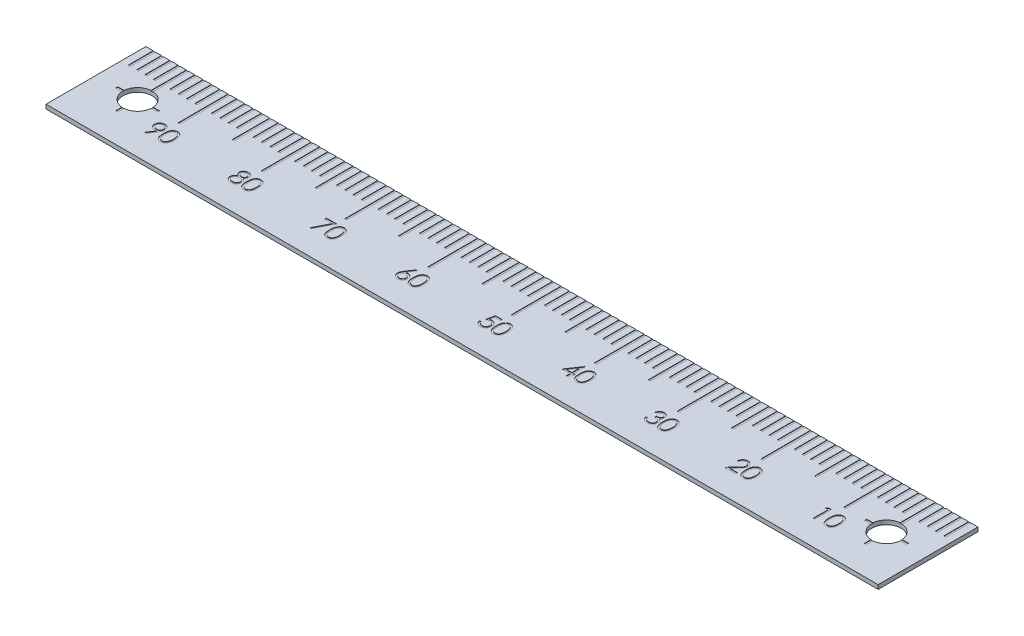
SolidWorks part; units mm, degrees
ref_plane "Front Plane" through (0, 0, 0) normal (0, 0, 1) x (1, 0, 0)
ref_plane "Top Plane" through (0, 0, 0) normal (0, 1, 0) x (1, 0, 0)
ref_plane "Right Plane" through (0, 0, 0) normal (1, 0, 0) x (0, 0, -1)
sketch "Sketch1" plane through (0, 0, 0) normal (0, 1, 0) x (1, 0, 0)
  line L1 (-50, 6) -> (50, 6)
  line L2 (-50, 6) -> (-50, -6)
  line L3 (-50, -6) -> (50, -6)
  line L4 (50, 6) -> (50, -6)
extrude "Boss-Extrude1" add sketch "Sketch1" against normal blind 0.5
sketch "Sketch2" plane through (0, 0, 0) normal (0, 1, 0) x (1, 0, 0)
  line L1 (-49.125, 3) -> (-48.875, 3)
  line L2 (-49.125, 3) -> (-49.125, 6)
  line L3 (-49.125, 6) -> (-48.875, 6)
  line L4 (-48.875, 3) -> (-48.875, 6)
  line L5 (-49, 6) -> (-49, 3) construction
  line L6 (-50, 6) -> (-50, -6) construction
  dimension "D1" = 3
  dimension "D2" = 0.25
  dimension "D3" = 1
extrude "Cut-Extrude2" cut sketch "Sketch2" against normal blind 0.05 contours L4 L3 L2 L1
pattern_linear "LPattern2" count 99 spacing 1 along (1, 0, 0) of "Cut-Extrude2"
sketch "Sketch3" plane through (0, 0, 0) normal (0, 1, 0) x (1, 0, 0)
  line L0 (-40.125, 3) -> (-40.125, 6) construction
  line L6 (-40.125, 3) -> (-39.875, 3)
  line L7 (-40.125, 3) -> (-40.125, 0)
  line L8 (-40.125, 0) -> (-39.875, 0)
  line L9 (-39.875, 3) -> (-39.875, 0)
  dimension "D1" = 0
  dimension "D2" = 0.25
  dimension "D4" = 3
extrude "Cut-Extrude3" cut sketch "Sketch3" against normal blind 0.05
pattern_linear "LPattern3" count 9 spacing 10 along (1, 0, 0) of "Cut-Extrude3"
sketch "Sketch4" plane through (0, 0, 0) normal (0, 1, 0) x (1, 0, 0)
  line L0 (-35.125, 3) -> (-35.125, 6) construction
  line L1 (-35.125, 3) -> (-34.875, 3)
  line L2 (-35.125, 3) -> (-35.125, 1.5)
  line L3 (-35.125, 1.5) -> (-34.875, 1.5)
  line L4 (-34.875, 3) -> (-34.875, 1.5)
  dimension "D1" = 0
  dimension "D2" = 0.25
  dimension "D3" = 3
  dimension "D4" = 1.5
extrude "Cut-Extrude4" cut sketch "Sketch4" against normal blind 0.05
pattern_linear "LPattern4" count 9 spacing 10 along (1, 0, 0) count 2 spacing 10 along (-1, 0, 0) of "Cut-Extrude4"
sketch "Sketch5" plane through (0, 0, 0) normal (0, 1, 0) x (1, 0, 0)
  line L0 (-44.995, 0) -> (-44.995, 2.5) construction
  line L1 (-44.995, 0) -> (-44.995, -2.5) construction
  line L2 (-44.995, 0) -> (-42.495, 0) construction
  line L3 (-44.995, 0) -> (-47.495, 0) construction
  line L5 (-45.12, 2.5) -> (-44.87, 2.5)
  line L6 (-45.12, 2.5) -> (-45.12, 1.7455)
  line L7 (-45.12, -2.5) -> (-44.87, -2.5)
  line L8 (-44.87, 2.5) -> (-44.87, 1.7455)
  line L9 (-47.495, 0.125) -> (-46.7405, 0.125)
  line L10 (-47.495, 0.125) -> (-47.495, -0.125)
  line L11 (-47.495, -0.125) -> (-46.7405, -0.125)
  line L12 (-42.495, 0.125) -> (-42.495, -0.125)
  line L13 (-48.125, 6) -> (-48.875, 6) construction
  line L14 (-45.12, 1.4948) -> (-45.12, 0.125)
  line L15 (-44.87, 1.4948) -> (-44.87, 0.125)
  line L16 (-43.2495, 0.125) -> (-42.495, 0.125)
  line L17 (-43.2495, -0.125) -> (-42.495, -0.125)
  line L18 (-44.87, -1.7455) -> (-44.87, -2.5)
  line L19 (-45.12, -1.7455) -> (-45.12, -2.5)
  line L20 (-46.4898, -0.125) -> (-45.12, -0.125)
  line L21 (-46.4898, 0.125) -> (-45.12, 0.125)
  line L22 (-44.87, -0.125) -> (-44.87, -1.4948)
  line L23 (-44.87, 0.125) -> (-43.5002, 0.125)
  line L24 (-45.12, -0.125) -> (-45.12, -1.4948)
  line L25 (-44.87, -0.125) -> (-43.5002, -0.125)
  arc A0 (-45.12, 1.4948) -> (-46.4898, 0.125) centre (-44.995, 0) ccw
  arc A1 (-45.12, 1.7455) -> (-46.7405, 0.125) centre (-44.995, 0) ccw
  arc A2 (-43.5002, 0.125) -> (-44.87, 1.4948) centre (-44.995, 0) ccw
  arc A3 (-43.2495, 0.125) -> (-44.87, 1.7455) centre (-44.995, 0) ccw
  arc A4 (-44.87, -1.4948) -> (-43.5002, -0.125) centre (-44.995, 0) ccw
  arc A5 (-44.87, -1.7455) -> (-43.2495, -0.125) centre (-44.995, 0) ccw
  arc A6 (-46.4898, -0.125) -> (-45.12, -1.4948) centre (-44.995, 0) ccw
  arc A7 (-46.7405, -0.125) -> (-45.12, -1.7455) centre (-44.995, 0) ccw
  point P34 (-44.995, 2.5)
extrude "Cut-Extrude6" cut sketch "Sketch5" against normal blind 0.05
pattern_linear "LPattern5" count 2 spacing 90 along (1, 0, 0) of "Cut-Extrude6"
sketch "Sketch7" plane through (0, 0, 0) normal (0, 1, 0) x (1, 0, 0)
  line L0 (-50, -6) -> (50, -6) construction
  line L1 (-50, 6) -> (-50, -6) construction
  text T0 "10         20         30         40" font "Century Gothic" height 2
  dimension "D1" = 3
  dimension "D2" = 8.5
extrude "Cut-Extrude7" [suppressed] cut sketch "Sketch7" against normal blind 0.05
sketch "Sketch11" plane through (0, 0, 0) normal (0, 1, 0) x (1, 0, 0)
  line L0 (-50, -6) -> (50, -6) construction
  line L1 (-50, 6) -> (-50, -6) construction
  text T0 "50         60         70         80         90" font "Century Gothic" height 2
  dimension "D1" = 3
  dimension "D2" = 48.5
extrude "Cut-Extrude8" [suppressed] cut sketch "Sketch11" against normal blind 0.05
sketch "Sketch14" plane through (0, 0, 0) normal (0, 1, 0) x (1, 0, 0)
  line L0 (-50, -6) -> (50, -6) construction
  line L1 (-50, 6) -> (-50, -6) construction
  text T0 "100       110       120       130       140" font "Century Gothic" height 2
  dimension "D1" = 3
  dimension "D2" = 97.5
extrude "Cut-Extrude10" [suppressed] cut sketch "Sketch14" against normal blind 0.05
sketch "Sketch15" plane through (0, 0, 0) normal (0, 1, 0) x (1, 0, 0)
  line L0 (-50, 6) -> (-50, -6) construction
  line L1 (-50, -6) -> (50, -6) construction
  text T0 "40         30         20         10" font "Century Gothic" height 2
  dimension "D1" = 58.5
  dimension "D2" = 3
extrude "Cut-Extrude12" cut sketch "Sketch15" against normal blind 0.05
sketch "Sketch18" plane through (0, 0, 0) normal (0, 1, 0) x (1, 0, 0)
  line L0 (-50, -6) -> (50, -6) construction
  line L1 (-50, 6) -> (-50, -6) construction
  text T0 "90         80         70         60         50" font "Century Gothic" height 2
  dimension "D1" = 3
  dimension "D2" = 8.5
extrude "Cut-Extrude13" cut sketch "Sketch18" against normal blind 0.05
sketch "Sketch19" plane through (0, 0, 0) normal (0, 1, 0) x (1, 0, 0)
  line L0 (-50, 6) -> (-50, -6) construction
  line L1 (-50, -6) -> (50, -6) construction
  text T0 "140       130       120       110       100" font "Century Gothic" height 2
  dimension "D1" = 7.5
  dimension "D2" = 3
extrude "Cut-Extrude14" [suppressed] cut sketch "Sketch19" against normal blind 0.05
sketch "Sketch20" plane through (0, 0, 0) normal (0, 1, 0) x (1, 0, 0)
  circle A0 centre (-44.995, 0) radius 1.75
extrude "Cut-Extrude15" cut sketch "Sketch20" against normal blind 0.5
pattern_linear "LPattern6" count 2 spacing 90 along (1, 0, 0) of "Cut-Extrude15"
sketch "Sketch21" plane through (0, 0, 0) normal (0, 1, 0) x (1, 0, 0)
  line L0 (-50, -6) -> (50, -6) construction
  line L1 (-50, 6) -> (-50, -6) construction
  text T0 "10         20         30         40         50         40         30         20         10" font "Century Gothic" height 2
  dimension "D1" = 3
  dimension "D2" = 8.5
extrude "Cut-Extrude17" [suppressed] cut sketch "Sketch21" against normal blind 0.05
sketch "Sketch22" plane through (0, 0, 0) normal (0, 1, 0) x (1, 0, 0)
  line L0 (-50, -6) -> (50, -6) construction
  line L1 (-50, 6) -> (-50, -6) construction
  text T0 "10         20         30         40         50         60         70         80         90        100        90         80         70         60         50         40         30         20         10" font "Century Gothic" height 2
  dimension "D1" = 3
  dimension "D2" = 8.5
extrude "Cut-Extrude18" [suppressed] cut sketch "Sketch22" against normal blind 0.05
sketch "Sketch23" plane through (0, 0, 0) normal (0, 1, 0) x (1, 0, 0)
  line L0 (-50, -6) -> (50, -6) construction
  line L2 (-50, 6) -> (-50, -6) construction
  text T0 "10         20         30         40         50         60         70         80         90        100       110       120       130       140       150       160       170       180       190       20" font "Century Gothic" height 2
  dimension "D1" = 3
  dimension "D2" = 8.5
extrude "Cut-Extrude19" [suppressed] cut sketch "Sketch23" against normal blind 0.05
sketch "Sketch24" plane through (0, 0, 0) normal (0, 1, 0) x (1, 0, 0)
  line L0 (-50, -6) -> (50, -6) construction
  line L1 (-50, 6) -> (-50, -6) construction
  text T0 "10         20         30         40         50         60         70         80         90        100       110       120       130       140       150       160       170       180       190" font "Century Gothic" height 2
  dimension "D1" = 3
  dimension "D2" = 8.5
extrude "Cut-Extrude20" [suppressed] cut sketch "Sketch24" against normal blind 0.05
sketch "Sketch26" plane through (0, 0, 0) normal (0, 1, 0) x (1, 0, 0)
  line L0 (-50, -6) -> (50, -6) construction
  line L1 (-50, 6) -> (-50, -6) construction
  text T0 "190       180       170       160       150       140       130       120       110       100        90         80         70         60         50         40         30         20         10" font "Century Gothic" height 2
  dimension "D1" = 3
  dimension "D2" = 7.5
extrude "Cut-Extrude21" [suppressed] cut sketch "Sketch26" against normal blind 0.05
sketch "Sketch27" plane through (0, 0, 0) normal (0, 1, 0) x (1, 0, 0)
  line L0 (-50, -6) -> (50, -6) construction
  line L1 (-50, 6) -> (-50, -6) construction
  text T0 "490       480       470       460       450       440       430       420       410       400       390       380       370       360       350       340       330       320       310       300       " font "Century Gothic" height 2
  dimension "D1" = 3
  dimension "D2" = 7.5
extrude "Cut-Extrude22" [suppressed] cut sketch "Sketch27" against normal blind 0.05
sketch "Sketch29" plane through (0, 0, 0) normal (0, 1, 0) x (1, 0, 0)
  line L0 (-50, -6) -> (50, -6) construction
  line L1 (-50, 6) -> (-50, -6) construction
  text T0 "10         20         30         40         50         60         70         80         90        100       110       120       130       140       150       160       170       180       190       20" font "Century Gothic" height 2
  dimension "D1" = 3
  dimension "D2" = 8.5
extrude "Cut-Extrude23" [suppressed] cut sketch "Sketch29" against normal blind 0.05
sketch "Sketch30" plane through (0, 0, 0) normal (0, 1, 0) x (1, 0, 0)
  line L0 (-50, -6) -> (50, -6) construction
  line L1 (-50, 6) -> (-50, -6) construction
  text T0 "240       230       220       210       200       190       180       170       160       150       140       130       120       110       100        90         80         70         60         50   " font "Century Gothic" height 2
  dimension "D1" = 3
  dimension "D2" = 7.5
extrude "Cut-Extrude24" [suppressed] cut sketch "Sketch30" against normal blind 0.05
sketch "Sketch31" [suppressed] plane through (0, 0, 0) normal (0, 1, 0) x (1, 0, 0)
  line L0 (-100, -6) -> (100, -6) construction
  line L1 (-100, 6) -> (-100, -6) construction
  text T0 "150       160       170       180       190" font "Century Gothic" height 2
  dimension "D1" = 3
  dimension "D2" = 148.5
extrude "Cut-Extrude25" [suppressed] cut sketch "Sketch31" against normal blind 0.05
sketch "Sketch32" [suppressed] plane through (0, 0, 0) normal (0, 1, 0) x (1, 0, 0)
  line L0 (-25, -6) -> (25, -6) construction
  line L1 (-24.125, -6) -> (-23.875, -6)
  line L2 (-24.125, -6) -> (-24.125, -3)
  line L3 (-24.125, -3) -> (-23.875, -3)
  line L4 (-23.875, -6) -> (-23.875, -3)
  line L5 (-24, -3) -> (-24, -6) construction
  line L6 (-25, 6) -> (-25, -6) construction
  dimension "D1" = 0.25
  dimension "D2" = 3
  dimension "D3" = 1
extrude "Cut-Extrude26" [suppressed] cut sketch "Sketch32" against normal blind 0.05
pattern_linear "LPattern7" [suppressed] count 99 spacing 1
sketch "Sketch34" [suppressed] plane through (0, 0, 0) normal (0, 1, 0) x (1, 0, 0)
  line L1 (-245.125, -3) -> (-244.875, -3)
  line L2 (-245.125, -3) -> (-245.125, -1.5)
  line L3 (-245.125, -1.5) -> (-244.875, -1.5)
  line L4 (-244.875, -3) -> (-244.875, -1.5)
  dimension "D1" = 1.5
  dimension "D2" = 0.25
extrude "Cut-Extrude27" [suppressed] cut sketch "Sketch34" against normal blind 0.05
pattern_linear "LPattern8" [suppressed] count 4 spacing 10
sketch "Sketch35" [suppressed] plane through (0, 0, 0) normal (0, 1, 0) x (1, 0, 0)
  line L1 (-240.125, -3) -> (-239.875, -3)
  line L2 (-240.125, -3) -> (-240.125, 0)
  line L3 (-240.125, 0) -> (-239.875, 0)
  line L4 (-239.875, -3) -> (-239.875, 0)
  dimension "D1" = 3
  dimension "D2" = 0.25
extrude "Cut-Extrude28" [suppressed] cut sketch "Sketch35" against normal blind 0.05
pattern_linear "LPattern9" [suppressed] count 4 spacing 10
equation "\"D2@Sketch1\"=\"D1@Sketch1\"/2"
equation "\"D4@Sketch1\"=\"D3@Sketch1\"/2"
equation "\"D8@Sketch5\"=\"D7@Sketch5\"/2"
equation "\"D10@Sketch5\"=\"D9@Sketch5\"/2"
